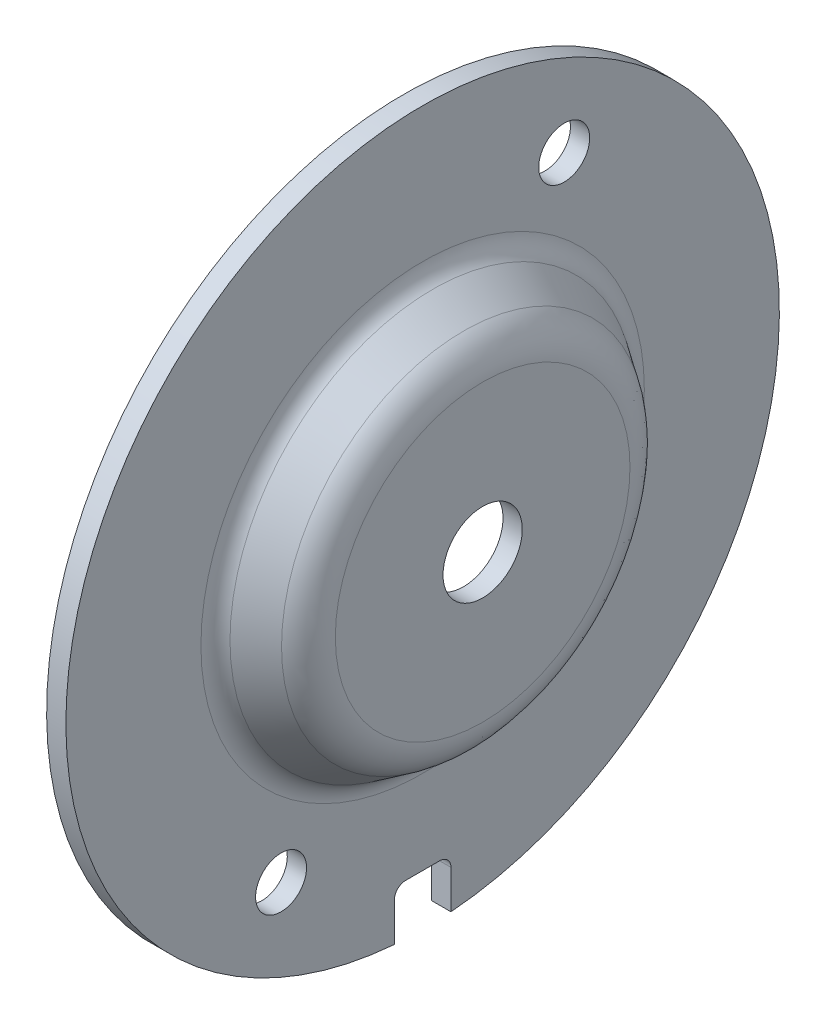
SolidWorks part; units mm, degrees
ref_plane "Face" through (0, 0, 0) normal (0, 0, 1) x (1, 0, 0)
ref_plane "Dessus" through (0, 0, 0) normal (0, 1, 0) x (1, 0, 0)
ref_plane "Droite" through (0, 0, 0) normal (1, 0, 0) x (0, 0, -1)
sketch "Esquisse1" plane through (0, 0, 0) normal (0, 0, 1) x (1, 0, 0)
  line L0 (0, 0) -> (78.9608, 0) construction
  line L1 (53, 31.5) -> (54.7, 31.5)
  line L2 (54.7, 31.5) -> (54.7, 19.576)
  line L3 (55.5979, 17.9071) -> (58.3389, 16.0969)
  line L4 (60, 13.0094) -> (60, 3.5)
  line L5 (60, 3.5) -> (58.3, 3.5)
  line L6 (58.3, 3.5) -> (58.3, 13.0094)
  line L7 (57.4021, 14.6783) -> (54.6611, 16.4885)
  line L8 (53, 19.576) -> (53, 31.5)
  line L9 (53, -33) -> (53, 33) construction
  arc A0 (55.5979, 17.9071) -> (54.7, 19.576) centre (56.7, 19.576) cw
  arc A1 (58.3, 13.0094) -> (57.4021, 14.6783) centre (56.3, 13.0094) ccw
  arc A2 (54.6611, 16.4885) -> (53, 19.576) centre (56.7, 19.576) cw
  arc A3 (60, 13.0094) -> (58.3389, 16.0969) centre (56.3, 13.0094) ccw
  point P15 (54.7, 18.5)
  point P22 (60, 15)
  dimension "D9" = 2
  dimension "D10" = 3.7
  dimension "D1" = 63
  dimension "D2" = 1.7
  dimension "D3" = 7
  dimension "D4" = 1.7
  dimension "D5" = 1.7
  dimension "D6" = 37
  dimension "D7" = 30
  dimension "D8" = 7
revolve "Révolution1" add sketch "Esquisse1" angle 360 about L0
sketch "Esquisse2" plane through (54.7, 0, 0) normal (1, 0, 0) x (0, 0, -1)
  circle A0 centre (12.5, 21.6506) radius 2.25
  circle A1 centre (-12.5, -21.6506) radius 2.25
  dimension "D1" = 4.5
  dimension "D2" = 4.5
extrude "Enlèv. mat.-Extru.1" cut sketch "Esquisse2" against normal through all
sketch "Esquisse3" plane through (54.7, 0, 0) normal (1, 0, 0) x (0, 0, -1)
  line L0 (-2.5, -31.4006) -> (-2.5, -27)
  line L1 (-2.5, -27) -> (2.5, -27)
  line L2 (2.5, -27) -> (2.5, -31.4006)
  circle A0 centre (0, 0) radius 31.5 construction
  arc A1 (-2.5, -31.4006) -> (2.5, -31.4006) centre (0, 0) ccw
  dimension "D1" = 5
  dimension "D2" = 2.5
  dimension "D3" = 27
extrude "Enlèv. mat.-Extru.2" cut sketch "Esquisse3" against normal through all
fillet "Congé1" radius 1
